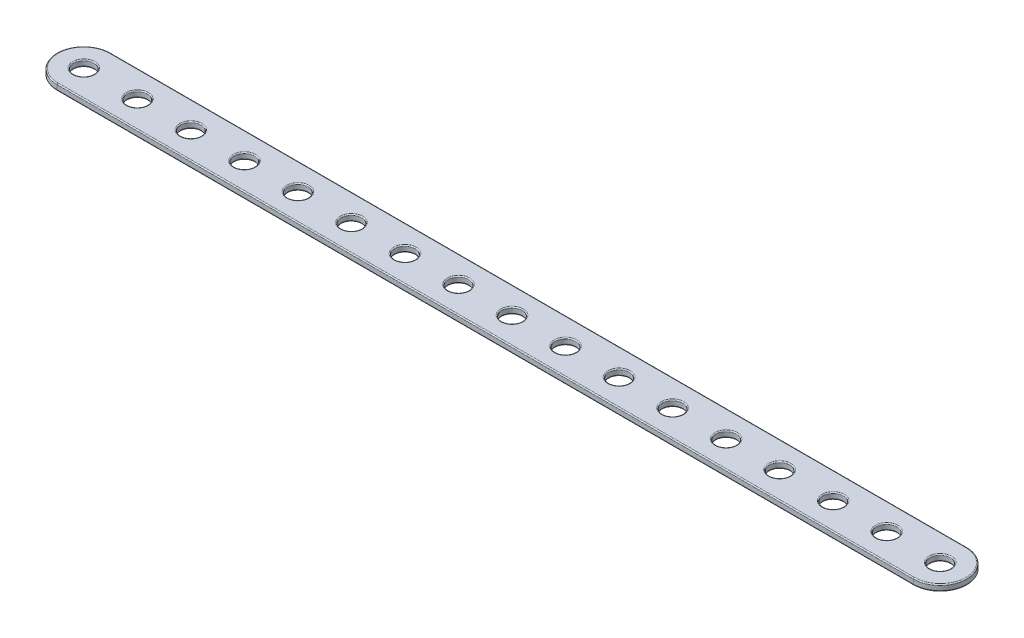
SolidWorks part; units mm, degrees
ref_plane "Front" through (0, 0, 0) normal (0, 0, 1) x (1, 0, 0)
ref_plane "Top" through (0, 0, 0) normal (0, 1, 0) x (1, 0, 0)
ref_plane "Right" through (0, 0, 0) normal (1, 0, 0) x (0, 0, -1)
sketch "Sketch1" plane through (0, 0, 0) normal (0, 1, 0) x (1, 0, 0)
  line L1 (0, 0) -> (203.2, 0)
  line L3 (0, 12.7) -> (203.2, 12.7)
  arc A0 (0, 12.7) -> (0, 0) centre (0, 6.35) ccw
  arc A1 (203.2, 0) -> (203.2, 12.7) centre (203.2, 6.35) ccw
  dimension "D1" = 12.7
  dimension "D2" = 203.2
extrude "Extrude1" add sketch "Sketch1" along normal blind 1.524
sketch "Sketch2" plane through (0, 1.524, 0) normal (0, 1, 0) x (-1, 0, 0)
  line L0 (-203.2, -12.7) -> (0, -12.7) construction
  circle A0 centre (0, -6.35) radius 2.413
  dimension "D2" = 4.826
  dimension "D1" = 6.35
extrude "Cut-Extrude1" cut sketch "Sketch2" against normal through all
pattern_linear "LPattern1" count 17 spacing 12.7 along (1, 0, 0) of "Cut-Extrude1"
fillet "Fillet1" radius 0.254 42 edges at (209.55, 1.524, -6.35) (101.6, 1.524, -12.7) (0, 0, -3.937) (0, 1.524, -3.937) (12.7, 0, -3.937) (12.7, 1.524, -3.937) (25.4, 0, -3.937) (25.4, 1.524, -3.937) (38.1, 0, -3.937) (38.1, 1.524, -3.937) (50.8, 0, -3.937) (50.8, 1.524, -3.937) (63.5, 0, -3.937) (63.5, 1.524, -3.937) (76.2, 0, -3.937) (76.2, 1.524, -3.937) (-6.35, 1.524, -6.35) (101.6, 0, -12.7) (88.9, 0, -3.937) (88.9, 1.524, -3.937) (209.55, 0, -6.35) (101.6, 0, -3.937) (101.6, 1.524, -3.937) (101.6, 0, 0) (114.3, 0, -3.937) (114.3, 1.524, -3.937) (127, 0, -3.937) (-6.35, 0, -6.35) (127, 1.524, -3.937) (139.7, 0, -3.937) (139.7, 1.524, -3.937) (152.4, 0, -3.937) (152.4, 1.524, -3.937) (165.1, 0, -3.937) (165.1, 1.524, -3.937) (177.8, 0, -3.937) (177.8, 1.524, -3.937) (101.6, 1.524, 0) (190.5, 0, -3.937) (190.5, 1.524, -3.937) (203.2, 0, -3.937) (203.2, 1.524, -3.937)
equation "\"D2@Sketch1\" = \"D3@LPattern1\" *  ( \"D1@LPattern1\" - 1 ) "
